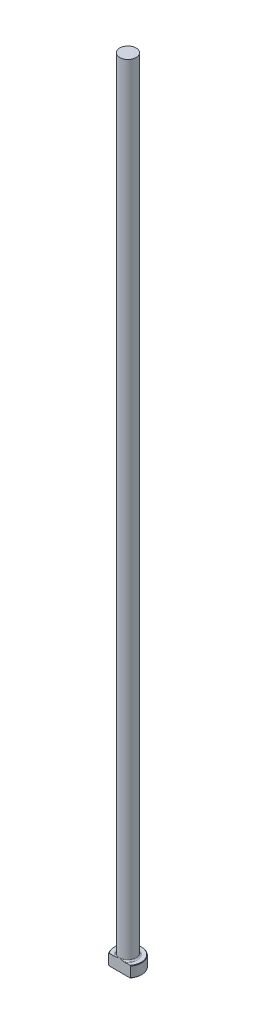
SolidWorks part; units mm, degrees
ref_plane "Front Plane" through (0, 0, 0) normal (0, 0, 1) x (1, 0, 0)
ref_plane "Top Plane" through (0, 0, 0) normal (0, 1, 0) x (1, 0, 0)
ref_plane "Right Plane" through (0, 0, 0) normal (1, 0, 0) x (0, 0, -1)
sketch "Sketch1" plane through (0, 0, 0) normal (0, 0, 1) x (1, 0, 0)
  line L0 (0, 259.9588) -> (0, -15.1925) construction
  line L1 (0, 0) -> (-7.9375, 0)
  line L2 (-7.9375, 0) -> (-7.9375, 6.35)
  line L3 (-7.9375, 6.35) -> (-4.7625, 6.35)
  line L4 (-4.7625, 6.35) -> (-4.7625, 457.2)
  line L5 (-4.7625, 457.2) -> (0, 457.2)
  line L6 (0, 457.2) -> (0, 0)
  dimension "L" = 457.2
  dimension "H" = 15.875
  dimension "T" = 6.35
  dimension "D" = 9.525
revolve "Revolve1" add sketch "Sketch1" angle 360 about L0
chamfer "Chamfer1" distance 0.254 angle 45 2 edges at (0, 6.35, 7.9375) (0, 0, 7.9375)
fillet "Fillet1" radius 0.762 1 edges at (0, 6.35, 4.7625)
sketch "Sketch2" plane through (0, 0, 0) normal (0, -1, 0) x (1, 0, 0)
  line L0 (-6.35, 4.7625) -> (6.35, 4.7625)
  arc A0 (6.35, 4.7625) -> (-6.35, 4.7625) centre (0, 0) ccw
  circle A1 centre (0, 0) radius 7.9375 construction
  circle A3 centre (0, 0) radius 4.7625 construction
extrude "KEY" cut sketch "Sketch2" against normal through all
sketch "Pocket Sketch" plane through (0, 0, 0) normal (0, 0, 1) x (1, 0, 0)
  line L0 (-8.3344, 0) -> (-8.3344, 6.3754)
  line L1 (-8.3344, 6.3754) -> (-5.9214, 6.3754)
  line L2 (-5.1594, 7.1374) -> (-5.1594, 22.225)
  line L3 (-5.1594, 22.225) -> (0, 22.225)
  line L4 (0, 22.225) -> (0, 0)
  line L5 (0, 0) -> (-8.3344, 0)
  line L6 (0, 12.6104) -> (0, -2.4989) construction
  line L7 (-7.9375, 6.096) -> (-7.9375, 0.254) construction
  line L8 (7.6835, 6.35) -> (-7.6835, 6.35) construction
  line L9 (-4.7625, 457.2) -> (-4.7625, 7.112) construction
  line L10 (-5.9214, 6.3754) -> (-5.1594, 7.1374)
  point P3 (-5.1594, 6.3754)
  dimension "D1" = 16.6687
  dimension "D2" = 0.3969
  dimension "D3" = 0.0254
  dimension "D4" = 0.3969
  dimension "D5" = 10.3187
  dimension "D6" = 22.225
